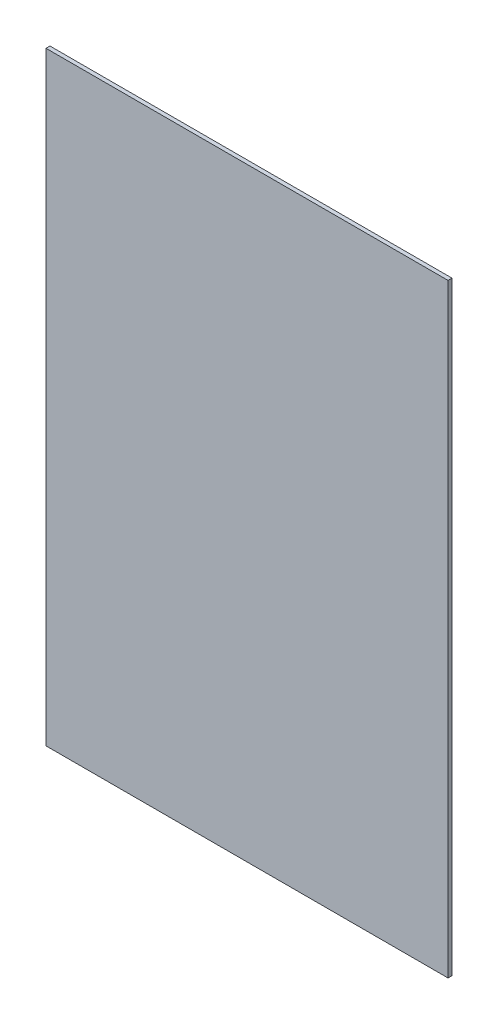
SolidWorks part; units mm, degrees
ref_plane "Plano frontal" through (0, 0, 0) normal (0, 0, 1) x (1, 0, 0)
ref_plane "Plano superior" through (0, 0, 0) normal (0, 1, 0) x (1, 0, 0)
ref_plane "Plano direito" through (0, 0, 0) normal (1, 0, 0) x (0, 0, -1)
sketch "Esboço1" plane through (0, 0, 0) normal (0, 0, 1) x (1, 0, 0)
  line L1 (0, 0) -> (-1830, 0)
  line L2 (0, 0) -> (0, 2750)
  line L3 (0, 2750) -> (-1830, 2750)
  line L4 (-1830, 0) -> (-1830, 2750)
  line L5 (0, 0) -> (-1830, 2750) construction
  line L6 (0, 2750) -> (-1830, 0) construction
  point P4 (-915, 1375)
extrude "Ressalto-extrusão1" add sketch "Esboço1" along normal blind 18
sketch "Esboço2" plane through (0, 0, 18) normal (0, 0, 1) x (1, 0, 0)
  line L0 (-1830, 0) -> (-1830, 2750) construction
  line L1 (-1340, 1375) -> (-840, 1375) construction
  line L2 (0, 0) -> (0, 2750) construction
  line L3 (-837, 1375) -> (-837, 2750) construction
  line L4 (-1830, 2750) -> (0, 2750) construction
  line L6 (-1830, 0) -> (0, 0) construction
  line L7 (-840, 2147) -> (0, 2147) construction
  line L8 (-1830, 1930) -> (-1330, 1930) construction
  line L9 (-1830, 1107) -> (-1330, 1107) construction
  line L10 (-1830, 1104) -> (-1330, 1104) construction
  line L11 (-1830, 1927) -> (-1330, 1927) construction
  line L12 (-1830, 284) -> (-1330, 284) construction
  line L14 (-840, 1981) -> (-837, 1981) construction
  line L15 (-840, 2067) -> (-837, 2067) construction
  line L16 (-840, 2064) -> (-837, 2064) construction
  line L18 (-840, 1984) -> (-837, 1984) construction
  line L19 (-1330, 172) -> (-1330, 2750) construction
  line L20 (-840, 1901) -> (-837, 1901) construction
  line L21 (-840, -401351.7492) -> (-840, -201489.24) construction
  line L22 (-1340, 2495) -> (-840, 2495) construction
  line L23 (-840, 1898) -> (-837, 1898) construction
  line L24 (-1340, 2485) -> (-840, 2485) construction
  line L25 (-840, 1375) -> (-840, 2750) construction
  line L26 (-1340, 2230) -> (-840, 2230) construction
  line L27 (-840, 1550) -> (0, 1550) construction
  line L28 (-1340, 2220) -> (-840, 2220) construction
  line L29 (-231, 1550) -> (-231, 2150) construction
  line L30 (-1340, 1965) -> (-840, 1965) construction
  line L31 (-840, 1540) -> (0, 1540) construction
  line L32 (-1340, 1955) -> (-840, 1955) construction
  line L33 (-840, 1390) -> (0, 1390) construction
  line L34 (-1340, 1670) -> (-840, 1670) construction
  line L36 (-840, 2150) -> (0, 2150) construction
  line L37 (-840, 1380) -> (0, 1380) construction
  line L38 (-1340, 2150) -> (-1330, 2150) construction
  line L39 (-1340, 1670) -> (-840, 1670) construction
  line L40 (-1340, 1660) -> (-840, 1660) construction
  line L41 (-840, 2067) -> (47286.5386, 2067) construction
  line L42 (-840, 1230) -> (0, 1230) construction
  line L43 (-840, 1220) -> (0, 1220) construction
  line L44 (-1830, 2750) -> (0, 2750) construction
  line L45 (-840, 1984) -> (47286.5386, 1984) construction
  line L46 (-234, 1550) -> (-234, 2150) construction
  line L47 (-840, 1375) -> (-840, 2750) construction
  line L48 (-672, 2150) -> (-672, 2750) construction
  line L49 (-840, 1070) -> (0, 1070) construction
  line L50 (-507, 2150) -> (-507, 2750) construction
  line L51 (-840, 1981) -> (47286.5386, 1981) construction
  line L52 (-504, 2150) -> (-504, 2750) construction
  line L53 (-840, 1060) -> (0, 1060) construction
  line L54 (-304, 1550) -> (-304, 2150) construction
  line L55 (-840, 1901) -> (47286.5386, 1901) construction
  line L56 (-339, 2150) -> (-339, 2750) construction
  line L57 (-307, 1550) -> (-307, 2150) construction
  line L58 (-840, 910) -> (0, 910) construction
  line L59 (-377, 1550) -> (-377, 2150) construction
  line L60 (-3, 0) -> (-3, 2750) construction
  line L61 (-336, 2150) -> (-336, 2750) construction
  line L62 (-840, 1898) -> (47286.5386, 1898) construction
  line L63 (-380, 1550) -> (-380, 2150) construction
  line L64 (-840, 900) -> (0, 900) construction
  line L65 (-171, 2150) -> (-171, 2750) construction
  line L66 (-450, 1550) -> (-450, 2150) construction
  line L67 (-168, 2150) -> (-168, 2750) construction
  line L68 (-840, 750) -> (0, 750) construction
  line L69 (-453, 1550) -> (-453, 2150) construction
  line L70 (-840, 740) -> (0, 740) construction
  line L71 (-523, 1550) -> (-523, 2150) construction
  line L72 (-840, 590) -> (0, 590) construction
  line L73 (-526, 1550) -> (-526, 2150) construction
  line L74 (-596, 1550) -> (-596, 2150) construction
  line L75 (-599, 1550) -> (-599, 2150) construction
  line L76 (-669, 1550) -> (-669, 2750) construction
  line L77 (-672, 1550) -> (-672, 2750) construction
  line L78 (-840, 580) -> (0, 580) construction
  line L79 (-840, 430) -> (0, 430) construction
  line L80 (-840, 420) -> (0, 420) construction
  line L81 (-840, 280) -> (0, 280) construction
  line L82 (-840, 270) -> (0, 270) construction
  line L83 (-840, 270) -> (47286.5386, 270) construction
  line L84 (-840, 280) -> (47286.5386, 280) construction
  line L85 (-840, 420) -> (47286.5386, 420) construction
  line L86 (-840, 430) -> (47286.5386, 430) construction
  line L87 (-840, 580) -> (47286.5386, 580) construction
  line L88 (-840, 590) -> (47286.5386, 590) construction
  line L89 (-840, 740) -> (47286.5386, 740) construction
  line L90 (-840, 750) -> (47286.5386, 750) construction
  line L91 (-840, 900) -> (47286.5386, 900) construction
  line L92 (-840, 910) -> (47286.5386, 910) construction
  line L93 (-840, 1060) -> (47286.5386, 1060) construction
  line L94 (-840, 1070) -> (47286.5386, 1070) construction
  line L95 (-840, 1220) -> (47286.5386, 1220) construction
  line L96 (-840, 1230) -> (47286.5386, 1230) construction
  line L97 (-840, 1380) -> (47286.5386, 1380) construction
  line L98 (-840, 1390) -> (47286.5386, 1390) construction
  line L99 (-840, 1540) -> (47286.5386, 1540) construction
  line L100 (-840, 1550) -> (47286.5386, 1550) construction
  line L101 (-840, 2147) -> (47286.5386, 2147) construction
  line L102 (-840, 2150) -> (47286.5386, 2150) construction
  line L103 (-672, 251150) -> (-672, 451673.2692) construction
  line L104 (-837, 250375) -> (-837, 451260.76) construction
  line L108 (-837, 0) -> (-837, 2750) construction
  line L109 (-1340, 775) -> (-840, 775) construction
  line L110 (-1340, 772) -> (-840, 772) construction
  line L111 (-1340, 172) -> (-840, 172) construction
  line L118 (-78, 2147) -> (-78, 2150) construction
  line L119 (-81, 2147) -> (-81, 2150) construction
  line L120 (-1340, 172) -> (-1340, 2750) construction
  dimension "D1" = 3
  dimension "D15" = 150
  dimension "D7" = 3
  dimension "D14" = 10
  dimension "D18" = 10
  dimension "D8" = 80
  dimension "D17" = 150
  dimension "D19" = 150
  dimension "D2" = 10
  dimension "D3" = 80
  dimension "D4" = 165
  dimension "D5" = 165
  dimension "D6" = 165
  dimension "D13" = 150
  dimension "D10" = 3
  dimension "D9" = 3
  dimension "D11" = 150
  dimension "D12" = 10
  dimension "D16" = 10
  dimension "D20" = 10
  dimension "D21" = 150
  dimension "D22" = 10
  dimension "D23" = 150
  dimension "D24" = 10
  dimension "D25" = 150
  dimension "D26" = 10
